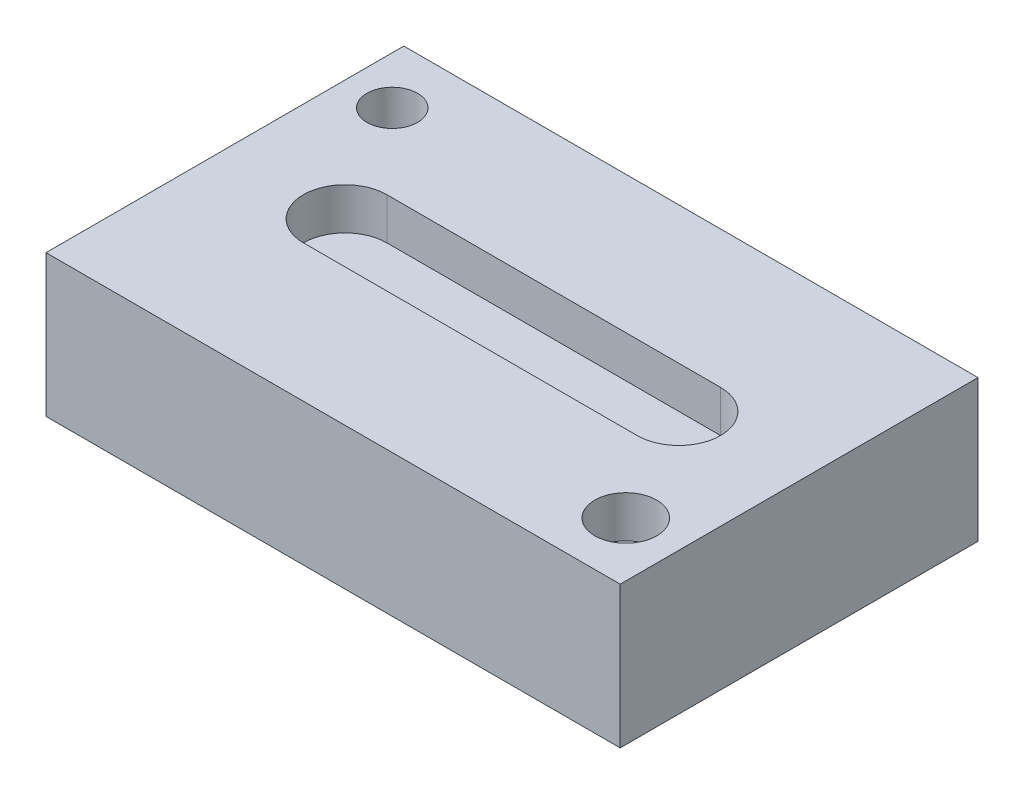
SolidWorks part; units mm, degrees
ref_plane "Front Plane" through (0, 0, 0) normal (0, 0, 1) x (1, 0, 0)
ref_plane "Top Plane" through (0, 0, 0) normal (0, 1, 0) x (1, 0, 0)
ref_plane "Right Plane" through (0, 0, 0) normal (1, 0, 0) x (0, 0, -1)
sketch "Sketch1" plane through (0, 0, 0) normal (0, 1, 0) x (1, 0, 0)
  line L1 (-87.3981, -54.4636) -> (87.3981, -54.4636)
  line L2 (-87.3981, -54.4636) -> (-87.3981, 54.4636)
  line L3 (-87.3981, 54.4636) -> (87.3981, 54.4636)
  line L4 (87.3981, -54.4636) -> (87.3981, 54.4636)
  line L5 (-87.3981, -54.4636) -> (87.3981, 54.4636) construction
  line L6 (-87.3981, 54.4636) -> (87.3981, -54.4636) construction
  point P0 (0, 0)
extrude "Boss-Extrude1" add sketch "Sketch1" along normal blind 43.18
sketch "Sketch2" plane through (0, 43.18, 0) normal (0, 1, 0) x (1, 0, 0)
  line L0 (-50.8, 0) -> (50.8, 0) construction
  line L1 (-50.8, 12.7) -> (50.8, 12.7)
  line L2 (-50.8, -12.7) -> (50.8, -12.7)
  arc A0 (-50.8, 12.7) -> (-50.8, -12.7) centre (-50.8, 0) ccw
  arc A1 (50.8, -12.7) -> (50.8, 12.7) centre (50.8, 0) ccw
  circle A2 centre (-72.874, 36.4086) radius 7.6974
  circle A3 centre (70.8013, -36.1578) radius 9.4308
  point P2 (0, 0)
  dimension "D2" = 101.6
  dimension "D1" = 25.4
extrude "Cut-Extrude1" cut sketch "Sketch2" against normal blind 12.7
